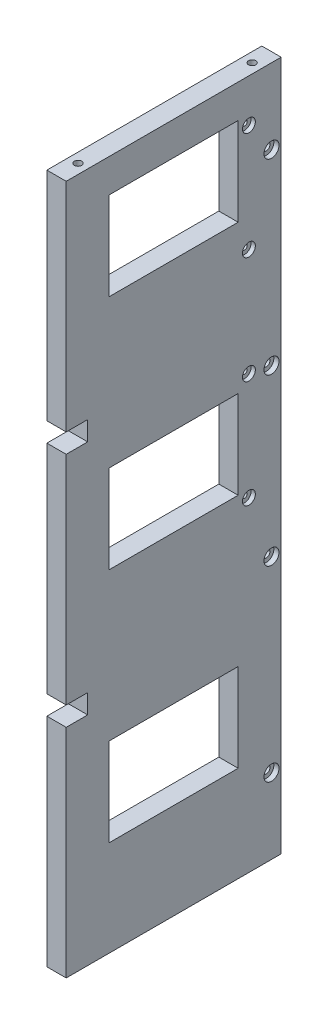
SolidWorks part; units mm, degrees
ref_plane "Front Plane" through (0, 0, 0) normal (0, 0, 1) x (1, 0, 0)
ref_plane "Top Plane" through (0, 0, 0) normal (0, 1, 0) x (1, 0, 0)
ref_plane "Right Plane" through (0, 0, 0) normal (1, 0, 0) x (0, 0, -1)
body saved out of another part "Stock-V1-1"
move or copy body "Body-Move/Copy1" bodies to move or copy 101 copy no rotation origin (-130.5, 0, 100) rotation axis (0, 1, 0) rotation angle 180
other "Move Face1" parameters "D1"=0.75
